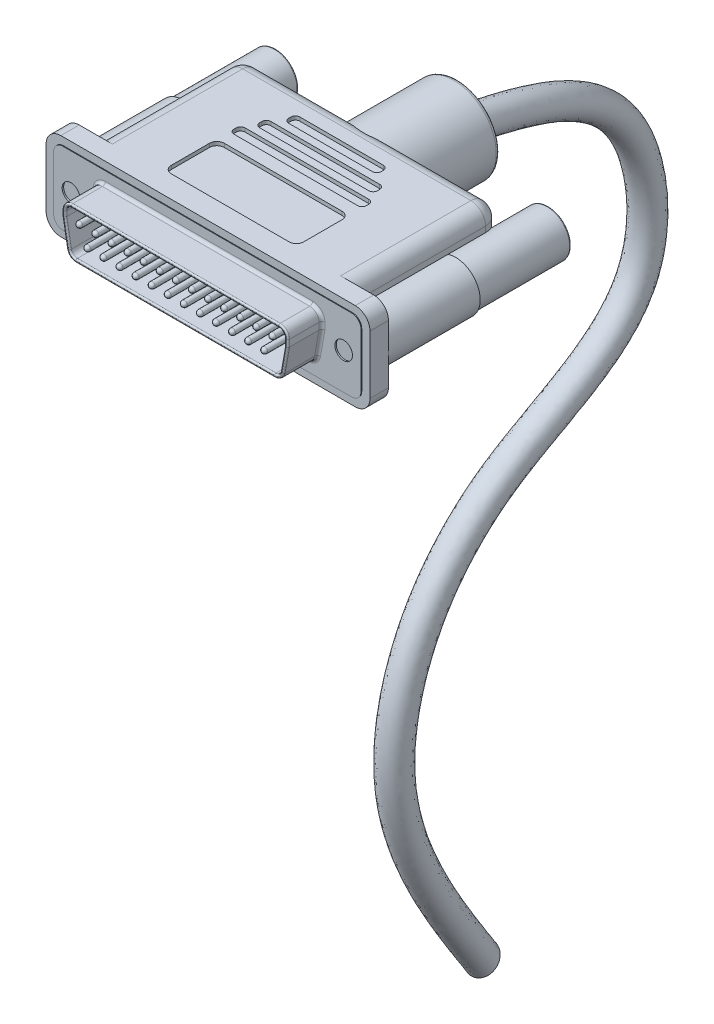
SolidWorks part; units mm, degrees
ref_plane "Plane1" through (0, 0, 0) normal (0, 0, 1) x (1, 0, 0)
ref_plane "Plane2" through (0, 0, 0) normal (0, 1, 0) x (1, 0, 0)
ref_plane "Plane3" through (0, 0, 0) normal (1, 0, 0) x (0, 0, -1)
sketch "Sketch1" plane through (0, 0, 0) normal (0, 0, 1) x (1, 0, 0)
  line L0 (0, 19.6596) -> (0, -19.1008) construction
  line L1 (-24.9174, 6.2738) -> (24.9174, 6.2738)
  line L2 (24.9174, -6.2738) -> (-24.9174, -6.2738)
  line L3 (26.5176, 4.6736) -> (26.5176, -4.6736)
  line L4 (-26.5176, 4.6736) -> (-26.5176, -4.6736)
  arc A0 (26.5176, 4.6736) -> (24.9174, 6.2738) centre (24.9174, 4.6736) ccw
  arc A1 (24.9174, -6.2738) -> (26.5176, -4.6736) centre (24.9174, -4.6736) ccw
  arc A2 (-26.5176, -4.6736) -> (-24.9174, -6.2738) centre (-24.9174, -4.6736) ccw
  arc A3 (-24.9174, 6.2738) -> (-26.5176, 4.6736) centre (-24.9174, 4.6736) ccw
  point P9 (26.5176, 6.2738)
  point P12 (26.5176, -6.2738)
  point P15 (-26.5176, -6.2738)
  point P18 (-26.5176, 6.2738)
  dimension "D1" = 1.6002
extrude "Base-Extrude" add sketch "Sketch1" against normal blind 1.0668
sketch "Sketch2" plane through (0, 0, -1.0668) normal (0, 0, -1) x (-1, 0, 0)
  line L0 (-26.5176, 6.2738) -> (26.5176, 6.2738)
  line L1 (-26.5176, 6.2738) -> (-26.5176, -6.2738)
  line L2 (26.5176, -6.2738) -> (-26.5176, -6.2738)
  line L3 (26.5176, -6.2738) -> (26.5176, 6.2738)
extrude "Boss-Extrude1" add sketch "Sketch2" along normal blind 6.477
sketch "Sketch3" plane through (0, 0, 0) normal (0, 0, 1) x (1, 0, 0)
  line L0 (0, 9.4234) -> (0, -12.192) construction
  line L1 (-17.5895, 4.1783) -> (18.1737, 4.1783)
  line L2 (17.4436, -4.1783) -> (-16.8191, -4.1783)
  line L4 (19.7739, 1.4224) -> (19.0195, -2.856)
  line L5 (19.7739, 2.5781) -> (19.7739, 1.4224)
  line L6 (-19.1897, 1.651) -> (-18.395, -2.856)
  line L7 (-19.1897, 2.5781) -> (-19.1897, 1.651)
  arc A0 (18.1737, 4.1783) -> (19.7739, 2.5781) centre (18.1737, 2.5781) cw
  arc A1 (17.4436, -4.1783) -> (19.0195, -2.856) centre (17.4436, -2.5781) ccw
  arc A2 (-18.395, -2.856) -> (-16.8191, -4.1783) centre (-16.8191, -2.5781) ccw
  arc A3 (-17.5895, 4.1783) -> (-19.1897, 2.5781) centre (-17.5895, 2.5781) ccw
  point P19 (19.7739, 4.1783)
  point P26 (-19.1897, 4.1783)
  dimension "D7" = 1.6002
  dimension "D1" = 38.9636
  dimension "D3" = 4.1783
  dimension "D4" = 4.1783
  dimension "D5" = 10
  dimension "D6" = 10
extrude "Boss-Extrude2" add sketch "Sketch3" along normal blind 5.842
sketch "Sketch10" plane through (0, 0, 0) normal (0, 0, 1) x (1, 0, 0)
  line L0 (0, 10.3378) -> (0, -10.8966) construction
  line L1 (-24.9174, 6.2738) -> (24.9174, 6.2738) construction
  circle A0 centre (23.5204, 0) radius 1.524
  circle A1 centre (-23.5204, 0) radius 1.524
  dimension "D1" = 3.048
  dimension "D2" = 6.2738
  dimension "D3" = 47.0408
extrude "Cut-Extrude5" cut sketch "Sketch10" against normal through all
sketch "Sketch11" plane through (0, 0, 5.842) normal (0, 0, 1) x (1, 0, 0)
  circle A0 centre (0, 1.4224) radius 0.508
  circle A2 centre (16.6497, 1.4224) radius 0.508
  circle A3 centre (11.1023, 1.4224) radius 0.508
  circle A4 centre (-2.7813, 1.4224) radius 0.508
  circle A5 centre (8.3287, 1.4224) radius 0.508
  circle A6 centre (-8.3287, 1.4224) radius 0.508
  circle A7 centre (5.555, 1.4224) radius 0.508
  circle A8 centre (-11.1023, 1.4224) radius 0.508
  circle A9 centre (2.7813, 1.4224) radius 0.508
  circle A10 centre (-13.876, 1.4224) radius 0.508
  circle A11 centre (13.876, 1.4224) radius 0.508
  circle A12 centre (-16.6497, 1.4224) radius 0.508
  circle A13 centre (15.2476, -1.4224) radius 0.508
  circle A25 centre (-5.555, 1.4224) radius 0.508
  circle A26 centre (-15.2629, -1.4224) radius 0.508
  circle A27 centre (12.4739, -1.4224) radius 0.508
  circle A28 centre (-12.4892, -1.4224) radius 0.508
  circle A29 centre (9.7003, -1.4224) radius 0.508
  circle A30 centre (-9.7155, -1.4224) radius 0.508
  circle A31 centre (6.9266, -1.4224) radius 0.508
  circle A32 centre (-6.9418, -1.4224) radius 0.508
  circle A33 centre (4.1529, -1.4224) radius 0.508
  circle A34 centre (-4.1681, -1.4224) radius 0.508
  circle A35 centre (1.3792, -1.4224) radius 0.508
  circle A36 centre (-1.3945, -1.4224) radius 0.508
  dimension "D2" = 1.016
  dimension "D5" = 2.7737
  dimension "D6" = 2.7737
  dimension "D7" = 2.7737
  dimension "D8" = 2.7737
  dimension "D9" = 2.7737
  dimension "D10" = 2.7737
  dimension "D11" = 2.7737
  dimension "D12" = 2.7737
  dimension "D13" = 2.7737
  dimension "D14" = 2.7737
  dimension "D15" = 1.3868
  dimension "D16" = 2.7737
  dimension "D17" = 2.7737
  dimension "D18" = 2.7737
  dimension "D19" = 2.7737
  dimension "D20" = 2.7737
  dimension "D21" = 2.7737
  dimension "D22" = 2.7737
  dimension "D23" = 2.7737
  dimension "D24" = 2.7737
  dimension "D25" = 2.7737
  dimension "D26" = 2.7737
ref_plane "Plane5" through (5.715, 0, 0) normal (1, 0, 0) x (0, 0, -1)
sketch "Sketch16" plane through (0, 0, 5.842) normal (0, 0, 1) x (1, 0, 0)
  line L6 (19.2151, 1.4713) -> (19.2151, 2.5781)
  line L7 (18.1737, 3.6195) -> (-17.5895, 3.6195)
  line L8 (-18.6309, 2.5781) -> (-18.6309, 1.6999)
  line L9 (-18.6309, 1.6999) -> (-17.8447, -2.7589)
  line L10 (-16.8191, -3.6195) -> (17.4436, -3.6195)
  line L11 (18.4692, -2.7589) -> (19.2151, 1.4713)
  line L12 (19.2151, 1.4713) -> (19.2151, 2.5781)
  line L13 (18.1737, 3.6195) -> (-17.5895, 3.6195)
  line L14 (-18.6309, 2.5781) -> (-18.6309, 1.6999)
  line L15 (-18.6309, 1.6999) -> (-17.8447, -2.7589)
  line L16 (-16.8191, -3.6195) -> (17.4436, -3.6195)
  line L17 (18.4692, -2.7589) -> (19.2151, 1.4713)
  arc A4 (19.2151, 2.5781) -> (18.1737, 3.6195) centre (18.1737, 2.5781) ccw
  arc A5 (-17.5895, 3.6195) -> (-18.6309, 2.5781) centre (-17.5895, 2.5781) ccw
  arc A6 (-17.8447, -2.7589) -> (-16.8191, -3.6195) centre (-16.8191, -2.5781) ccw
  arc A7 (17.4436, -3.6195) -> (18.4692, -2.7589) centre (17.4436, -2.5781) ccw
  arc A8 (19.2151, 2.5781) -> (18.1737, 3.6195) centre (18.1737, 2.5781) ccw
  arc A9 (-17.5895, 3.6195) -> (-18.6309, 2.5781) centre (-17.5895, 2.5781) ccw
  arc A10 (-17.8447, -2.7589) -> (-16.8191, -3.6195) centre (-16.8191, -2.5781) ccw
  arc A11 (17.4436, -3.6195) -> (18.4692, -2.7589) centre (17.4436, -2.5781) ccw
  dimension "D1" = 0.5588
extrude "Cut-Extrude6" cut sketch "Sketch16" against normal blind 5.842
extrude "Boss-Extrude7" add sketch "Sketch11" against normal blind 5.842
fillet "Fillet1" radius 0.508 25 edges at (0.508, 1.4224, 5.842) (-17.1577, 1.4224, 5.842) (-14.384, 1.4224, 5.842) (-11.6103, 1.4224, 5.842) (-8.8367, 1.4224, 5.842) (-6.063, 1.4224, 5.842) (-3.2893, 1.4224, 5.842) (2.2733, 1.4224, 5.842) (5.047, 1.4224, 5.842) (7.8207, 1.4224, 5.842) (10.5943, 1.4224, 5.842) (13.368, 1.4224, 5.842) (16.1417, 1.4224, 5.842) (15.7556, -1.4224, 5.842) (12.9819, -1.4224, 5.842) (10.2083, -1.4224, 5.842) (7.4346, -1.4224, 5.842) (4.6609, -1.4224, 5.842) (1.8872, -1.4224, 5.842) (-1.9025, -1.4224, 5.842) (-4.6761, -1.4224, 5.842) (-7.4498, -1.4224, 5.842) (-10.2235, -1.4224, 5.842) (-12.9972, -1.4224, 5.842) (-15.7709, -1.4224, 5.842)
fillet "Fillet3" radius 0.254 20 edges at (19.7739, 2.0003, 5.842) (19.3052, 3.7096, 5.842) (0.2921, 4.1783, 5.842) (0.3123, -4.1783, 5.842) (19.3967, -0.7168, 5.842) (-18.721, 3.7096, 5.842) (-19.1897, 2.1146, 5.842) (-18.7923, -0.6025, 5.842) (-17.8477, -3.8039, 5.842) (18.4722, -3.8039, 5.842) (18.8421, -0.6438, 5.842) (19.2151, 2.0247, 5.842) (18.9101, 3.3145, 5.842) (0.2921, 3.6195, 5.842) (-18.3259, 3.3145, 5.842) (-18.6309, 2.139, 5.842) (-18.2378, -0.5295, 5.842) (-17.4885, -3.3759, 5.842) (0.3123, -3.6195, 5.842) (18.113, -3.3759, 5.842)
fillet "Fillet4" radius 0.508 10 edges at (-18.721, 3.7096, 0) (-19.1897, 2.1146, 0) (-18.7923, -0.6025, 0) (-17.8477, -3.8039, 0) (18.4722, -3.8039, 0) (19.7739, 2.0003, 0) (19.3967, -0.7168, 0) (0.3123, -4.1783, 0) (0.2921, 4.1783, 0) (19.3052, 3.7096, 0)
sketch "Sketch17" plane through (0, 6.2738, 0) normal (0, 1, 0) x (-1, 0, 0)
  line L8 (-24.9174, 0) -> (-24.9174, -1.0668)
  line L9 (-24.9174, -1.0668) -> (-26.5176, -1.0668)
  line L10 (-26.5176, -1.0668) -> (-26.5176, -7.5438)
  line L11 (-26.5176, -7.5438) -> (26.5176, -7.5438)
  line L12 (26.5176, -7.5438) -> (26.5176, -1.0668)
  line L13 (26.5176, -1.0668) -> (24.9174, -1.0668)
  line L14 (24.9174, -1.0668) -> (24.9174, 0)
  line L15 (24.9174, 0) -> (-24.9174, 0)
  line L17 (-24.9174, -1.0668) -> (-26.5176, -1.0668)
  line L18 (-26.5176, -1.0668) -> (-26.5176, -7.5438)
  line L19 (-26.5176, -7.5438) -> (26.5176, -7.5438)
  line L20 (26.5176, -7.5438) -> (26.5176, -1.0668)
  line L21 (26.5176, -1.0668) -> (-24.9174, -1.0668)
  dimension "D1" = 0
extrude "Cut-Extrude7" cut sketch "Sketch17" against normal through all
ref_plane "Plane6" through (0, 0, -0.127) normal (0, 0, 1) x (1, 0, 0)
sketch "Sketch18" plane through (0, 0, -0.127) normal (0, 0, 1) x (1, 0, 0)
  line L0 (-25.4, 7.5692) -> (25.4, 7.5692)
  line L1 (-27.94, 5.0292) -> (-27.94, -5.0292)
  line L2 (25.4, -7.5692) -> (-25.4, -7.5692)
  line L3 (27.94, -5.0292) -> (27.94, 5.0292)
  arc A0 (27.94, 5.0292) -> (25.4, 7.5692) centre (25.4, 5.0292) ccw
  arc A1 (25.4, -7.5692) -> (27.94, -5.0292) centre (25.4, -5.0292) ccw
  arc A2 (-27.94, -5.0292) -> (-25.4, -7.5692) centre (-25.4, -5.0292) ccw
  arc A3 (-25.4, 7.5692) -> (-27.94, 5.0292) centre (-25.4, 5.0292) ccw
  point P12 (23.5204, 0)
  point P13 (-23.5204, 0)
  dimension "D1" = 2.54
  dimension "D2" = 55.88
  dimension "D3" = 15.1384
  dimension "D4" = 7.5692
  dimension "D5" = 27.94
extrude "Boss-Extrude8" add sketch "Sketch18" against normal blind 3.175
sketch "Sketch19" plane through (0, 0, -3.302) normal (0, 0, -1) x (-1, 0, 0)
  line L0 (-19.685, 7.5692) -> (19.685, 7.5692)
  line L1 (-22.225, 5.0292) -> (-22.225, 4.0525)
  line L2 (19.685, -7.5692) -> (-19.685, -7.5692)
  line L3 (22.225, -5.0292) -> (22.225, -4.0525)
  line L4 (25.4, 7.5692) -> (-25.4, 7.5692) construction
  line L5 (-25.4, -7.5692) -> (25.4, -7.5692) construction
  line L6 (22.225, 4.0525) -> (22.225, 5.0292)
  line L7 (-22.225, -4.0525) -> (-22.225, -5.0292)
  arc A0 (22.225, 4.0525) -> (22.225, -4.0525) centre (23.5204, 0) ccw
  arc A1 (-22.225, -4.0525) -> (-22.225, 4.0525) centre (-23.5204, 0) ccw
  arc A2 (19.685, 7.5692) -> (22.225, 5.0292) centre (19.685, 5.0292) cw
  arc A3 (19.685, -7.5692) -> (22.225, -5.0292) centre (19.685, -5.0292) ccw
  arc A4 (-22.225, -5.0292) -> (-19.685, -7.5692) centre (-19.685, -5.0292) ccw
  arc A5 (-19.685, 7.5692) -> (-22.225, 5.0292) centre (-19.685, 5.0292) ccw
  point P20 (22.225, 7.5692)
  point P23 (22.225, -7.5692)
  point P28 (-22.225, 7.5692)
  dimension "D3" = 8.509
  dimension "D4" = 8.509
  dimension "D5" = 2.54
  dimension "D1" = 44.45
  dimension "D2" = 22.225
extrude "Boss-Extrude10" add sketch "Sketch19" along normal blind 25.019
fillet "Fillet10" radius 2.54 7 edges at (0, -7.5692, -28.321) (22.225, -4.5408, -28.321) (21.4811, -6.8253, -28.321) (-21.4811, -6.8253, -28.321) (-22.225, -4.5408, -28.321)
fillet "Fillet11" radius 2.54 7 edges at (-21.4811, 6.8253, -28.321) (0, 7.5692, -28.321) (-22.225, 4.5408, -28.321) (21.4811, 6.8253, -28.321) (22.225, 4.5408, -28.321)
sketch "Sketch20" plane through (0, 0, -0.127) normal (0, 0, 1) x (1, 0, 0)
  circle A1 centre (-23.5204, 0) radius 1.524
  circle A2 centre (-23.5204, 0) radius 1.524
  circle A3 centre (23.5204, 0) radius 1.524
  circle A4 centre (23.5204, 0) radius 1.524
  dimension "D1" = 0
  dimension "D2" = 0
sketch "Sketch21" plane through (0, 0, -3.302) normal (0, 0, -1) x (-1, 0, 0)
  circle A0 centre (23.5204, 0) radius 4.2545
  circle A1 centre (-23.5204, 0) radius 4.2545
  arc A2 (22.225, 4.0525) -> (22.225, -4.0525) centre (23.5204, 0) ccw construction
extrude "Boss-Extrude13" add sketch "Sketch21" along normal blind 16.002
sketch "Sketch23" plane through (0, 0, -19.304) normal (0, 0, -1) x (-1, 0, 0)
  circle A0 centre (23.5204, 0) radius 1.5875
  circle A1 centre (-23.5204, 0) radius 1.5875
  dimension "D1" = 3.175
  dimension "D2" = 3.175
extrude "Boss-Extrude14" add sketch "Sketch23" along normal blind 0.127
sketch "Sketch24" plane through (0, 0, -19.431) normal (0, 0, -1) x (-1, 0, 0)
  circle A0 centre (23.5204, 0) radius 3.937
  circle A1 centre (-23.5204, 0) radius 3.937
  dimension "D1" = 7.874
  dimension "D2" = 7.874
extrude "Boss-Extrude15" add sketch "Sketch24" along normal blind 15.875
extrude "Cut-Extrude9" cut sketch "Sketch20" against normal blind 0.127
fillet "Fillet12" radius 0.254 2 edges at (-27.4574, 0, -35.306) (19.5834, 0, -35.306)
sketch "Sketch25" plane through (0, 0, -35.306) normal (0, 0, -1) x (-1, 0, 0)
  line L0 (23.2987, 2.4625) -> (25.5122, -1.4647)
  line L1 (21.5286, 1.4647) -> (23.7421, -2.4625)
  line L2 (-23.7421, 2.4625) -> (-21.5286, -1.4647)
  line L3 (-25.5122, 1.4647) -> (-23.2987, -2.4625)
  arc A0 (24.5105, -2.7481) -> (25.3587, -2.27) centre (23.5204, 0) ccw
  arc A1 (23.2987, 2.4625) -> (22.5303, 2.7481) centre (22.7456, 2.1507) ccw
  arc A2 (21.5286, 1.4647) -> (21.6821, 2.27) centre (22.0817, 1.7765) cw
  arc A3 (24.5105, -2.7481) -> (23.7421, -2.4625) centre (24.2952, -2.1507) cw
  arc A4 (25.5122, -1.4647) -> (25.3587, -2.27) centre (24.9591, -1.7765) cw
  circle A5 centre (23.5204, 0) radius 2.921
  arc A6 (22.5303, 2.7481) -> (21.6821, 2.27) centre (23.5204, 0) ccw
  arc A9 (-22.5303, -2.7481) -> (-21.6821, -2.27) centre (-23.5204, 0) ccw
  arc A10 (-23.7421, 2.4625) -> (-24.5105, 2.7481) centre (-24.2952, 2.1507) ccw
  arc A11 (-25.5122, 1.4647) -> (-25.3587, 2.27) centre (-24.9591, 1.7765) cw
  arc A12 (-22.5303, -2.7481) -> (-23.2987, -2.4625) centre (-22.7456, -2.1507) cw
  arc A13 (-21.5286, -1.4647) -> (-21.6821, -2.27) centre (-22.0817, -1.7765) cw
  arc A14 (-24.5105, 2.7481) -> (-25.3587, 2.27) centre (-23.5204, 0) ccw
  dimension "D5" = 0.635
  dimension "D1" = 1.016
  dimension "D2" = 1.016
  dimension "D3" = 0.762
extrude "Cut-Extrude10" cut sketch "Sketch25" against normal blind 1.27
ref_plane "Plane7" through (0, 0, -43.18) normal (0, 0, 1) x (1, 0, 0)
sketch "Sketch26" plane through (0, 0, -43.18) normal (0, 0, 1) x (1, 0, 0)
  circle A0 centre (0, 0) radius 7.3025
  dimension "D1" = 14.605
extrude "Boss-Extrude16" add sketch "Sketch26" along normal up to next
fillet "Fillet13" radius 0.635 1 edges at (7.3025, 0, -43.18)
sketch "Sketch27" plane through (0, 0, -43.18) normal (0, 0, -1) x (-1, 0, 0)
  circle A0 centre (0, 0) radius 2.54
  dimension "D1" = 5.08
sketch "Sketch28" plane through (0, 0, 0) normal (1, 0, 0) x (0, 0, -1)
  spline_without_curve S0
sweep "Boss-Sweep1" add profiles "Sketch27" path "Sketch28"
sketch "Sketch29" plane through (0, 7.5692, 0) normal (0, 1, 0) x (-1, 0, 0)
  line L0 (-10.16, -13.081) -> (10.16, -13.081)
  line L1 (-11.43, -11.811) -> (-11.43, -5.207)
  line L2 (10.16, -3.937) -> (-10.16, -3.937)
  line L3 (11.43, -11.811) -> (11.43, -5.207)
  line L5 (25.4, -0.127) -> (-25.4, -0.127) construction
  line L6 (-10.668, -17.1704) -> (10.668, -17.1704)
  line L7 (-11.43, -16.4084) -> (-11.43, -16.0274)
  line L8 (10.668, -15.2654) -> (-10.668, -15.2654)
  line L9 (11.43, -16.0274) -> (11.43, -16.4084)
  line L10 (-9.398, -20.3454) -> (9.398, -20.3454)
  line L11 (-10.16, -19.5834) -> (-10.16, -19.2024)
  line L12 (9.398, -18.4404) -> (-9.398, -18.4404)
  line L13 (10.16, -19.2024) -> (10.16, -19.5834)
  line L14 (-6.858, -23.5204) -> (7.5667, -23.5204)
  line L15 (-7.62, -22.7584) -> (-7.62, -22.3774)
  line L16 (7.5667, -21.6154) -> (-6.858, -21.6154)
  line L17 (8.3287, -22.3774) -> (8.3287, -22.7584)
  line L18 (8.3287, 0) -> (8.3287, 5.334) construction
  arc A0 (-11.43, -5.207) -> (-10.16, -3.937) centre (-10.16, -5.207) cw
  arc A1 (-10.16, -13.081) -> (-11.43, -11.811) centre (-10.16, -11.811) cw
  arc A2 (11.43, -11.811) -> (10.16, -13.081) centre (10.16, -11.811) cw
  arc A3 (10.16, -3.937) -> (11.43, -5.207) centre (10.16, -5.207) cw
  arc A4 (-10.668, -15.2654) -> (-11.43, -16.0274) centre (-10.668, -16.0274) ccw
  arc A5 (-10.668, -17.1704) -> (-11.43, -16.4084) centre (-10.668, -16.4084) cw
  arc A6 (-9.398, -18.4404) -> (-10.16, -19.2024) centre (-9.398, -19.2024) ccw
  arc A7 (-9.398, -20.3454) -> (-10.16, -19.5834) centre (-9.398, -19.5834) cw
  arc A8 (-7.62, -22.3774) -> (-6.858, -21.6154) centre (-6.858, -22.3774) cw
  arc A9 (-6.858, -23.5204) -> (-7.62, -22.7584) centre (-6.858, -22.7584) cw
  arc A10 (10.668, -15.2654) -> (11.43, -16.0274) centre (10.668, -16.0274) cw
  arc A11 (10.668, -17.1704) -> (11.43, -16.4084) centre (10.668, -16.4084) ccw
  arc A12 (10.16, -19.2024) -> (9.398, -18.4404) centre (9.398, -19.2024) ccw
  arc A13 (9.398, -20.3454) -> (10.16, -19.5834) centre (9.398, -19.5834) ccw
  arc A14 (7.5667, -21.6154) -> (8.3287, -22.3774) centre (7.5667, -22.3774) cw
  arc A15 (7.5667, -23.5204) -> (8.3287, -22.7584) centre (7.5667, -22.7584) ccw
  point P6 (-11.43, -3.937)
  point P12 (-11.43, -13.081)
  point P53 (8.3287, -21.6154)
  dimension "D5" = 1.27
  dimension "D11" = 0.762
  dimension "D1" = 11.43
  dimension "D2" = 11.43
  dimension "D3" = 9.144
  dimension "D4" = 3.81
  dimension "D6" = 1.905
  dimension "D7" = 1.905
  dimension "D8" = 1.905
  dimension "D9" = 1.27
  dimension "D10" = 1.27
  dimension "D13" = 1.27
  dimension "D14" = 1.27
extrude "Cut-Extrude11" cut sketch "Sketch29" against normal blind 0.635
mirror "Mirror1" about plane through (0, 0, 0) normal (0, 1, 0) of "Cut-Extrude11"
